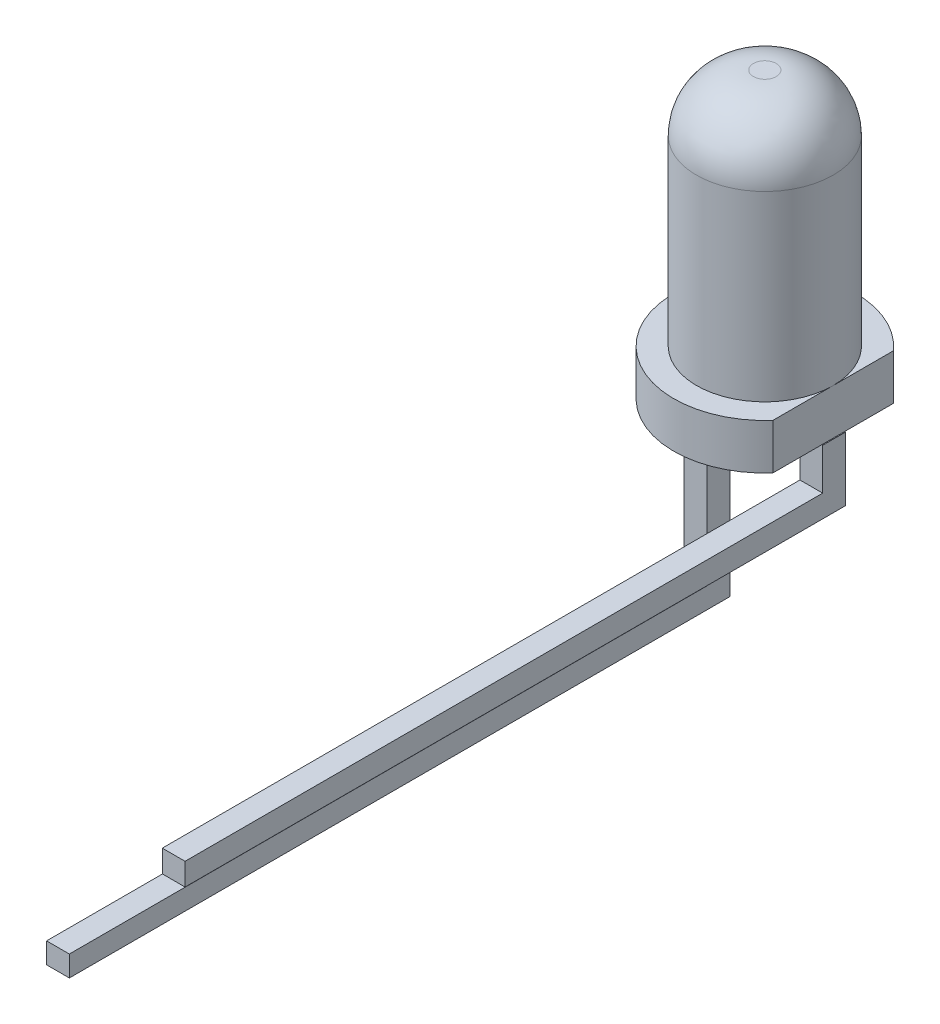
SolidWorks part; units mm, degrees
ref_plane "Front Plane" through (0, 0, 0) normal (0, 0, 1) x (1, 0, 0)
ref_plane "Top Plane" through (0, 0, 0) normal (0, 1, 0) x (1, 0, 0)
ref_plane "Right Plane" through (0, 0, 0) normal (1, 0, 0) x (0, 0, -1)
mirrored part "LED_Mirrored"
other "<LED>-<Boss-Extrude3>"
